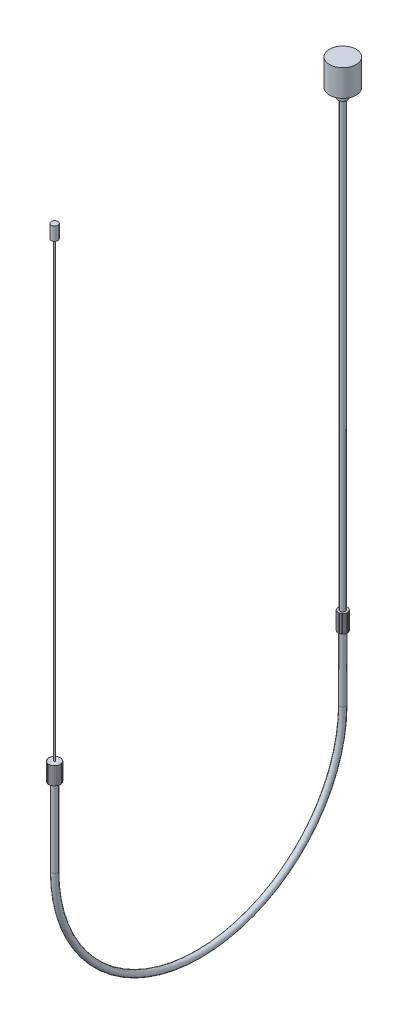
SolidWorks part; units mm, degrees
ref_plane "Alzado" through (0, 0, 0) normal (0, 0, 1) x (1, 0, 0)
ref_plane "Planta" through (0, 0, 0) normal (0, 1, 0) x (1, 0, 0)
ref_plane "Vista lateral" through (0, 0, 0) normal (1, 0, 0) x (0, 0, -1)
sketch "Croquis1" plane through (0, 0, 0) normal (0, 1, 0) x (1, 0, 0)
  circle A0 centre (0, 0) radius 30
  dimension "D1" = 60
extrude "Saliente-Extruir1" add sketch "Croquis1" along normal blind 60
sketch "Croquis2" plane through (0, 0, 0) normal (0, -1, 0) x (1, 0, 0)
  circle A0 centre (0, 0) radius 10
  dimension "D1" = 20
extrude "Saliente-Extruir2" add sketch "Croquis2" along normal blind 20 separate body
sketch "Croquis3" plane through (0, -20, 0) normal (0, -1, 0) x (1, 0, 0)
  circle A0 centre (0, 0) radius 6
  dimension "D1" = 12
extrude "Saliente-Extruir3" add sketch "Croquis3" along normal blind 1000 separate body
sketch "Croquis4" plane through (0, -1020, 0) normal (0, -1, 0) x (1, 0, 0)
  circle A0 centre (0, 0) radius 10
  dimension "D1" = 20
extrude "Saliente-Extruir4" add sketch "Croquis4" along normal blind 40 separate body
sketch "Croquis5" plane through (0, -1060, 0) normal (0, -1, 0) x (1, 0, 0)
  circle A0 centre (0, 0) radius 7
  dimension "D1" = 14
extrude "Cortar-Extruir1" cut sketch "Croquis5" against normal blind 30
sketch "Croquis6" plane through (0, 0, 0) normal (1, 0, 0) x (0, 0, -1)
  line L0 (0, -1030) -> (0, -1205)
  line L1 (-7, -1030) -> (7, -1030) construction
  line L2 (-650, -1205) -> (-650, -1030)
  arc A0 (0, -1205) -> (-650, -1205) centre (-325, -1205) cw
  dimension "D3" = 325
  dimension "D1" = 175
  dimension "D2" = 175
sweep "Barrer1" add path "Croquis6" parameters "D3"=13.5
sketch "Croquis35" plane through (0, -1020, 0) normal (0, 1, 0) x (1, 0, 0)
  line L0 (0, 0) -> (0, 10) construction
  line L1 (3.3377, 9.9836) -> (3.089, 9.015)
  line L2 (-0.75, 10.5) -> (0.75, 10.5)
  line L3 (-0.75, 10.5) -> (-0.75, 9.5)
  line L4 (-0.75, 9.5) -> (0.75, 9.5)
  line L5 (0.75, 10.5) -> (0.75, 9.5)
  line L6 (-0.75, 10.5) -> (0.75, 9.5) construction
  line L7 (-0.75, 9.5) -> (0.75, 10.5) construction
  line L8 (1.8848, 10.3566) -> (3.3377, 9.9836)
  line L9 (1.8848, 10.3566) -> (1.6361, 9.3881)
  line L10 (1.6361, 9.3881) -> (3.089, 9.015)
  line L11 (5.7156, 8.8399) -> (5.2339, 7.9636)
  line L12 (4.4012, 9.5625) -> (5.7156, 8.8399)
  line L13 (4.4012, 9.5625) -> (3.9194, 8.6862)
  line L14 (3.9194, 8.6862) -> (5.2339, 7.9636)
  line L15 (7.7345, 7.1408) -> (7.0499, 6.4118)
  line L16 (6.641, 8.1676) -> (7.7345, 7.1408)
  line L17 (6.641, 8.1676) -> (5.9565, 7.4386)
  line L18 (5.9565, 7.4386) -> (7.0499, 6.4118)
  line L19 (9.2673, 4.9929) -> (8.423, 4.4571)
  line L20 (8.4636, 6.2594) -> (9.2673, 4.9929)
  line L21 (8.4636, 6.2594) -> (7.6192, 5.7236)
  line L22 (7.6192, 5.7236) -> (8.423, 4.4571)
  line L23 (10.2179, 2.5314) -> (9.2668, 2.2224)
  line L24 (9.7543, 3.958) -> (10.2179, 2.5314)
  line L25 (9.7543, 3.958) -> (8.8033, 3.649)
  line L26 (8.8033, 3.649) -> (9.2668, 2.2224)
  line L27 (10.5264, -0.0892) -> (9.5283, -0.152)
  line L28 (10.4322, 1.4078) -> (10.5264, -0.0892)
  line L29 (10.4322, 1.4078) -> (9.4342, 1.345)
  line L30 (9.4342, 1.345) -> (9.5283, -0.152)
  line L31 (10.1735, -2.7042) -> (9.1912, -2.5168)
  line L32 (10.4546, -1.2308) -> (10.1735, -2.7042)
  line L33 (10.4546, -1.2308) -> (9.4723, -1.0434)
  line L34 (9.4723, -1.0434) -> (9.1912, -2.5168)
  line L35 (9.1813, -5.1493) -> (8.2765, -4.7235)
  line L36 (9.82, -3.7921) -> (9.1813, -5.1493)
  line L37 (9.82, -3.7921) -> (8.9152, -3.3663)
  line L38 (8.9152, -3.3663) -> (8.2765, -4.7235)
  line L39 (7.6123, -7.2708) -> (6.8418, -6.6334)
  line L40 (8.5685, -6.1151) -> (7.6123, -7.2708)
  line L41 (8.5685, -6.1151) -> (7.7979, -5.4776)
  line L42 (7.7979, -5.4776) -> (6.8418, -6.6334)
  line L43 (5.565, -8.9355) -> (4.9772, -8.1265)
  line L44 (6.7785, -8.0538) -> (5.565, -8.9355)
  line L45 (6.7785, -8.0538) -> (6.1907, -7.2448)
  line L46 (6.1907, -7.2448) -> (4.9772, -8.1265)
  line L47 (3.168, -10.0387) -> (2.7999, -9.109)
  line L48 (4.5626, -9.4866) -> (3.168, -10.0387)
  line L49 (4.5626, -9.4866) -> (4.1945, -8.5568)
  line L50 (4.1945, -8.5568) -> (2.7999, -9.109)
  line L51 (0.5719, -10.5112) -> (0.4466, -9.5191)
  line L52 (2.0601, -10.3232) -> (0.5719, -10.5112)
  line L53 (2.0601, -10.3232) -> (1.9348, -9.3311)
  line L54 (1.9348, -9.3311) -> (0.4466, -9.5191)
  line L55 (-2.0601, -10.3232) -> (-1.9348, -9.3311)
  line L56 (-0.5719, -10.5112) -> (-2.0601, -10.3232)
  line L57 (-0.5719, -10.5112) -> (-0.4466, -9.5191)
  line L58 (-0.4466, -9.5191) -> (-1.9348, -9.3311)
  line L59 (-4.5626, -9.4866) -> (-4.1945, -8.5568)
  line L60 (-3.168, -10.0387) -> (-4.5626, -9.4866)
  line L61 (-3.168, -10.0387) -> (-2.7999, -9.109)
  line L62 (-2.7999, -9.109) -> (-4.1945, -8.5568)
  line L63 (-6.7785, -8.0538) -> (-6.1907, -7.2448)
  line L64 (-5.565, -8.9355) -> (-6.7785, -8.0538)
  line L65 (-5.565, -8.9355) -> (-4.9772, -8.1265)
  line L66 (-4.9772, -8.1265) -> (-6.1907, -7.2448)
  line L67 (-8.5685, -6.1151) -> (-7.7979, -5.4776)
  line L68 (-7.6123, -7.2708) -> (-8.5685, -6.1151)
  line L69 (-7.6123, -7.2708) -> (-6.8418, -6.6334)
  line L70 (-6.8418, -6.6334) -> (-7.7979, -5.4776)
  line L71 (-9.82, -3.7921) -> (-8.9152, -3.3663)
  line L72 (-9.1813, -5.1493) -> (-9.82, -3.7921)
  line L73 (-9.1813, -5.1493) -> (-8.2765, -4.7235)
  line L74 (-8.2765, -4.7235) -> (-8.9152, -3.3663)
  line L75 (-10.4546, -1.2308) -> (-9.4723, -1.0434)
  line L76 (-10.1735, -2.7042) -> (-10.4546, -1.2308)
  line L77 (-10.1735, -2.7042) -> (-9.1912, -2.5168)
  line L78 (-9.1912, -2.5168) -> (-9.4723, -1.0434)
  line L79 (-10.4322, 1.4078) -> (-9.4342, 1.345)
  line L80 (-10.5264, -0.0892) -> (-10.4322, 1.4078)
  line L81 (-10.5264, -0.0892) -> (-9.5283, -0.152)
  line L82 (-9.5283, -0.152) -> (-9.4342, 1.345)
  line L83 (-9.7543, 3.958) -> (-8.8033, 3.649)
  line L84 (-10.2179, 2.5314) -> (-9.7543, 3.958)
  line L85 (-10.2179, 2.5314) -> (-9.2668, 2.2224)
  line L86 (-9.2668, 2.2224) -> (-8.8033, 3.649)
  line L87 (-8.4636, 6.2594) -> (-7.6192, 5.7236)
  line L88 (-9.2673, 4.9929) -> (-8.4636, 6.2594)
  line L89 (-9.2673, 4.9929) -> (-8.423, 4.4571)
  line L90 (-8.423, 4.4571) -> (-7.6192, 5.7236)
  line L91 (-6.641, 8.1676) -> (-5.9565, 7.4386)
  line L92 (-7.7345, 7.1408) -> (-6.641, 8.1676)
  line L93 (-7.7345, 7.1408) -> (-7.0499, 6.4118)
  line L94 (-7.0499, 6.4118) -> (-5.9565, 7.4386)
  line L95 (-4.4012, 9.5625) -> (-3.9194, 8.6862)
  line L96 (-5.7156, 8.8399) -> (-4.4012, 9.5625)
  line L97 (-5.7156, 8.8399) -> (-5.2339, 7.9636)
  line L98 (-5.2339, 7.9636) -> (-3.9194, 8.6862)
  line L99 (-1.8848, 10.3566) -> (-1.6361, 9.3881)
  line L100 (-3.3377, 9.9836) -> (-1.8848, 10.3566)
  line L101 (-3.3377, 9.9836) -> (-3.089, 9.015)
  line L102 (-3.089, 9.015) -> (-1.6361, 9.3881)
  circle A0 centre (0, 0) radius 10 construction
  point P108 (0, 0)
  dimension "D1" = 1.5
  dimension "D2" = 1
  dimension "D3" = 25
extrude "Saliente-Extruir5" add sketch "Croquis35" against normal blind 40
sketch "Croquis36" plane through (0, -1030, 0) normal (0, 1, 0) x (1, 0, 0)
  circle A0 centre (0, -650) radius 12.5
  dimension "D1" = 25
extrude "Saliente-Extruir6" add sketch "Croquis36" along normal blind 39.8 separate body
sketch "Croquis37" plane through (0, -990.2, 0) normal (0, 1, 0) x (1, 0, 0)
  line L0 (0, -650) -> (-12.5, -650) construction
  line L1 (-11.8717, -647.9843) -> (-11.3743, -646.0471)
  line L2 (-13, -651) -> (-12, -651)
  line L3 (-13, -651) -> (-13, -649)
  line L4 (-13, -649) -> (-12, -649)
  line L5 (-12, -651) -> (-12, -649)
  line L6 (-13, -651) -> (-12, -649) construction
  line L7 (-13, -649) -> (-12, -651) construction
  line L8 (-12.8403, -647.7356) -> (-12.3429, -645.7984)
  line L9 (-12.8403, -647.7356) -> (-11.8717, -647.9843)
  line L10 (-12.3429, -645.7984) -> (-11.3743, -646.0471)
  line L11 (-10.9974, -645.0953) -> (-10.0339, -643.3426)
  line L12 (-11.8737, -644.6135) -> (-10.9102, -642.8609)
  line L13 (-11.8737, -644.6135) -> (-10.9974, -645.0953)
  line L14 (-10.9102, -642.8609) -> (-10.0339, -643.3426)
  line L15 (-9.4322, -642.5144) -> (-8.0631, -641.0565)
  line L16 (-10.1611, -641.8299) -> (-8.792, -640.3719)
  line L17 (-10.1611, -641.8299) -> (-9.4322, -642.5144)
  line L18 (-8.792, -640.3719) -> (-8.0631, -641.0565)
  line L19 (-7.2742, -640.4039) -> (-5.5856, -639.3322)
  line L20 (-7.8101, -639.5596) -> (-6.1214, -638.4879)
  line L21 (-7.8101, -639.5596) -> (-7.2742, -640.4039)
  line L22 (-6.1214, -638.4879) -> (-5.5856, -639.3322)
  line L23 (-4.6593, -638.8963) -> (-2.7571, -638.2783)
  line L24 (-4.9683, -637.9453) -> (-3.0662, -637.3272)
  line L25 (-4.9683, -637.9453) -> (-4.6593, -638.8963)
  line L26 (-3.0662, -637.3272) -> (-2.7571, -638.2783)
  line L27 (-1.7515, -638.0865) -> (0.2445, -637.9609)
  line L28 (-1.8143, -637.0884) -> (0.1817, -636.9629)
  line L29 (-1.8143, -637.0884) -> (-1.7515, -638.0865)
  line L30 (0.1817, -636.9629) -> (0.2445, -637.9609)
  line L31 (1.2663, -638.0252) -> (3.2309, -638.3999)
  line L32 (1.4537, -637.0429) -> (3.4182, -637.4176)
  line L33 (1.4537, -637.0429) -> (1.2663, -638.0252)
  line L34 (3.4182, -637.4176) -> (3.2309, -638.3999)
  line L35 (4.2045, -638.7163) -> (6.0142, -639.5679)
  line L36 (4.6303, -637.8115) -> (6.44, -638.663)
  line L37 (4.6303, -637.8115) -> (4.2045, -638.7163)
  line L38 (6.44, -638.663) -> (6.0142, -639.5679)
  line L39 (6.8786, -640.1164) -> (8.4196, -641.3913)
  line L40 (7.516, -639.3459) -> (9.057, -640.6208)
  line L41 (7.516, -639.3459) -> (6.8786, -640.1164)
  line L42 (9.057, -640.6208) -> (8.4196, -641.3913)
  line L43 (9.1204, -642.1376) -> (10.296, -643.7556)
  line L44 (9.9294, -641.5498) -> (11.105, -643.1678)
  line L45 (9.9294, -641.5498) -> (9.1204, -642.1376)
  line L46 (11.105, -643.1678) -> (10.296, -643.7556)
  line L47 (10.7892, -644.6527) -> (11.5254, -646.5123)
  line L48 (11.719, -644.2846) -> (12.4552, -646.1442)
  line L49 (11.719, -644.2846) -> (10.7892, -644.6527)
  line L50 (12.4552, -646.1442) -> (11.5254, -646.5123)
  line L51 (11.78, -647.5039) -> (12.0307, -649.4881)
  line L52 (12.7722, -647.3786) -> (13.0228, -649.3628)
  line L53 (12.7722, -647.3786) -> (11.78, -647.5039)
  line L54 (13.0228, -649.3628) -> (12.0307, -649.4881)
  line L55 (12.0307, -650.5119) -> (11.78, -652.4961)
  line L56 (13.0228, -650.6372) -> (12.7722, -652.6214)
  line L57 (13.0228, -650.6372) -> (12.0307, -650.5119)
  line L58 (12.7722, -652.6214) -> (11.78, -652.4961)
  line L59 (11.5254, -653.4877) -> (10.7892, -655.3473)
  line L60 (12.4552, -653.8558) -> (11.719, -655.7154)
  line L61 (12.4552, -653.8558) -> (11.5254, -653.4877)
  line L62 (11.719, -655.7154) -> (10.7892, -655.3473)
  line L63 (10.296, -656.2444) -> (9.1204, -657.8624)
  line L64 (11.105, -656.8322) -> (9.9294, -658.4502)
  line L65 (11.105, -656.8322) -> (10.296, -656.2444)
  line L66 (9.9294, -658.4502) -> (9.1204, -657.8624)
  line L67 (8.4196, -658.6087) -> (6.8786, -659.8836)
  line L68 (9.057, -659.3792) -> (7.516, -660.6541)
  line L69 (9.057, -659.3792) -> (8.4196, -658.6087)
  line L70 (7.516, -660.6541) -> (6.8786, -659.8836)
  line L71 (6.0142, -660.4321) -> (4.2045, -661.2837)
  line L72 (6.44, -661.337) -> (4.6303, -662.1885)
  line L73 (6.44, -661.337) -> (6.0142, -660.4321)
  line L74 (4.6303, -662.1885) -> (4.2045, -661.2837)
  line L75 (3.2309, -661.6001) -> (1.2663, -661.9748)
  line L76 (3.4182, -662.5824) -> (1.4537, -662.9571)
  line L77 (3.4182, -662.5824) -> (3.2309, -661.6001)
  line L78 (1.4537, -662.9571) -> (1.2663, -661.9748)
  line L79 (0.2445, -662.0391) -> (-1.7515, -661.9135)
  line L80 (0.1817, -663.0371) -> (-1.8143, -662.9116)
  line L81 (0.1817, -663.0371) -> (0.2445, -662.0391)
  line L82 (-1.8143, -662.9116) -> (-1.7515, -661.9135)
  line L83 (-2.7571, -661.7217) -> (-4.6593, -661.1037)
  line L84 (-3.0662, -662.6728) -> (-4.9683, -662.0547)
  line L85 (-3.0662, -662.6728) -> (-2.7571, -661.7217)
  line L86 (-4.9683, -662.0547) -> (-4.6593, -661.1037)
  line L87 (-5.5856, -660.6678) -> (-7.2742, -659.5961)
  line L88 (-6.1214, -661.5121) -> (-7.8101, -660.4404)
  line L89 (-6.1214, -661.5121) -> (-5.5856, -660.6678)
  line L90 (-7.8101, -660.4404) -> (-7.2742, -659.5961)
  line L91 (-8.0631, -658.9435) -> (-9.4322, -657.4856)
  line L92 (-8.792, -659.6281) -> (-10.1611, -658.1701)
  line L93 (-8.792, -659.6281) -> (-8.0631, -658.9435)
  line L94 (-10.1611, -658.1701) -> (-9.4322, -657.4856)
  line L95 (-10.0339, -656.6574) -> (-10.9974, -654.9047)
  line L96 (-10.9102, -657.1391) -> (-11.8737, -655.3865)
  line L97 (-10.9102, -657.1391) -> (-10.0339, -656.6574)
  line L98 (-11.8737, -655.3865) -> (-10.9974, -654.9047)
  line L99 (-11.3743, -653.9529) -> (-11.8717, -652.0157)
  line L100 (-12.3429, -654.2016) -> (-12.8403, -652.2644)
  line L101 (-12.3429, -654.2016) -> (-11.3743, -653.9529)
  line L102 (-12.8403, -652.2644) -> (-11.8717, -652.0157)
  circle A0 centre (0, -650) radius 12.5 construction
  point P107 (0, -650)
  dimension "D1" = 1
  dimension "D2" = 2
  dimension "D3" = 25
extrude "Saliente-Extruir7" add sketch "Croquis37" against normal blind 39.8
sketch "Croquis38" plane through (0, -990.2, 0) normal (0, 1, 0) x (1, 0, 0)
  circle A0 centre (0, -650) radius 1.5
  dimension "D1" = 3
extrude "Saliente-Extruir8" add sketch "Croquis38" along normal blind 1020 separate body
sketch "Croquis39" plane through (0, 29.8, 0) normal (0, 1, 0) x (1, 0, 0)
  circle A0 centre (0, -650) radius 7.5
  dimension "D1" = 15
extrude "Saliente-Extruir9" add sketch "Croquis39" along normal blind 30 separate body
sketch "Croquis40" plane through (0, 0, 0) normal (1, 0, 0) x (0, 0, -1)
  line L0 (-30, 60) -> (-711.56, 60) construction
